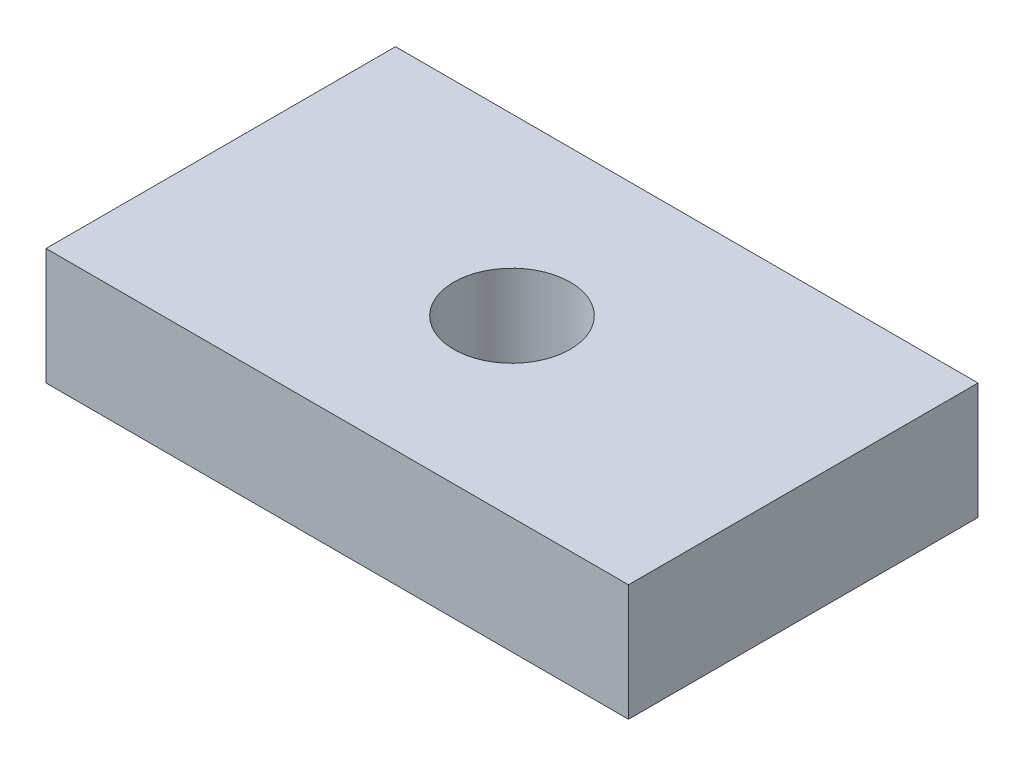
SolidWorks part; units mm, degrees
ref_plane "前视基准面" through (0, 0, 0) normal (0, 0, 1) x (1, 0, 0)
ref_plane "上视基准面" through (0, 0, 0) normal (0, 1, 0) x (1, 0, 0)
ref_plane "右视基准面" through (0, 0, 0) normal (1, 0, 0) x (0, 0, -1)
other "Configuration Table"
sketch "草图1" plane through (0, 0, 0) normal (0, 1, 0) x (1, 0, 0)
  line L1 (-50, -30) -> (50, -30)
  line L2 (-50, -30) -> (-50, 30)
  line L3 (-50, 30) -> (50, 30)
  line L4 (50, -30) -> (50, 30)
  line L5 (-50, -30) -> (50, 30) construction
  line L6 (-50, 30) -> (50, -30) construction
  point P0 (0, 0)
extrude "凸台-拉伸1" add sketch "草图1" along normal blind 20
sketch "草图2" plane through (0, 0, 0) normal (0, 1, 0) x (1, 0, 0)
  circle A0 centre (0, 0) radius 10
extrude "切除-拉伸1" cut sketch "草图2" along normal blind 25
